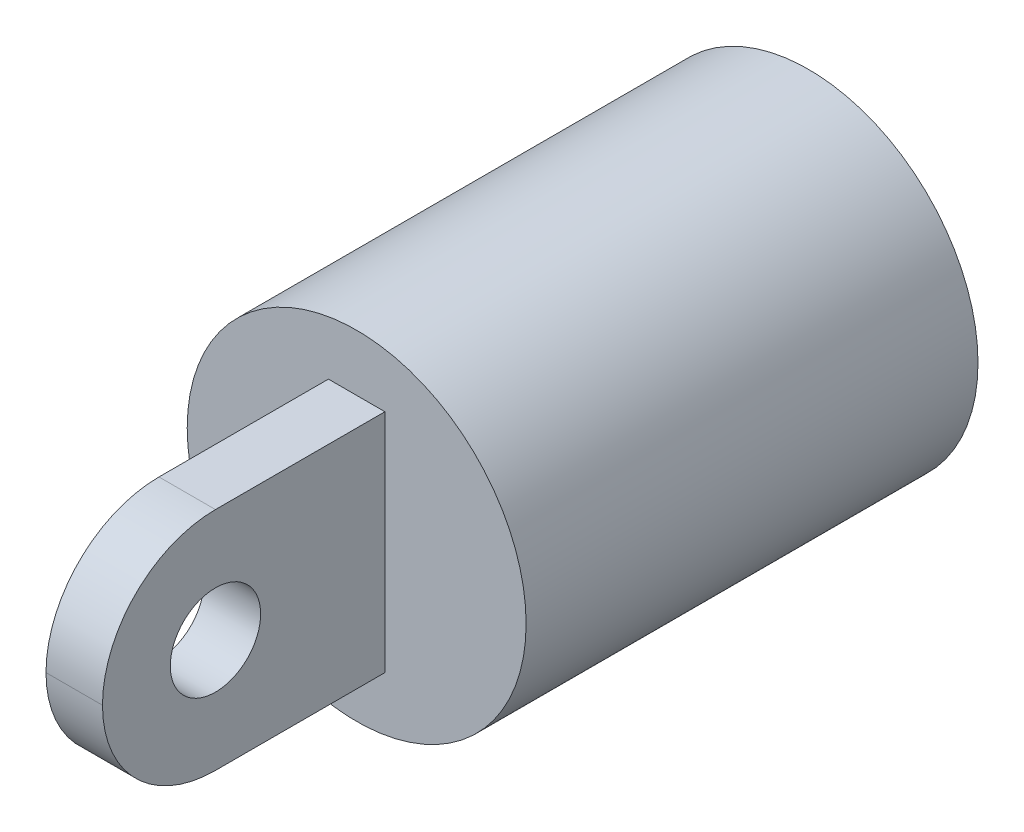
SolidWorks part; units mm, degrees
ref_plane "Plan de face" through (0, 0, 0) normal (0, 0, 1) x (1, 0, 0)
ref_plane "Plan de dessus" through (0, 0, 0) normal (0, 1, 0) x (1, 0, 0)
ref_plane "Plan de droite" through (0, 0, 0) normal (1, 0, 0) x (0, 0, -1)
sketch "Esquisse1" plane through (0, 0, 0) normal (0, 0, 1) x (1, 0, 0)
  circle A0 centre (0, 0) radius 15
  dimension "D1" = 30
extrude "Boss.-Extru.1" add sketch "Esquisse1" along normal blind 40
sketch "Esquisse2" plane through (0, 0, 40) normal (0, 0, 1) x (1, 0, 0)
  line L1 (-2.5, 10) -> (2.5, 10)
  line L2 (-2.5, 10) -> (-2.5, -10)
  line L3 (-2.5, -10) -> (2.5, -10)
  line L4 (2.5, 10) -> (2.5, -10)
  circle A0 centre (0, 0) radius 15 construction
  point P4 (0, 10)
  dimension "D1" = 20
  dimension "D2" = 5
  dimension "D3" = 10
  dimension "D4" = 2.5
extrude "Boss.-Extru.2" add sketch "Esquisse2" along normal blind 25
fillet "Congé1" radius 10 2 edges at (0, 10, 65) (0, -10, 65)
sketch "Esquisse4" plane through (2.5, 0, 0) normal (1, 0, 0) x (0, 0, -1)
  circle A0 centre (-55, 0) radius 4
  arc A1 (-55, 10) -> (-65, 0) centre (-55, 0) ccw construction
  dimension "D1" = 8
extrude "Enlèv. mat.-Extru.1" cut sketch "Esquisse4" against normal blind 25
sketch "Esquisse5" plane through (0, 0, 0) normal (0, 0, -1) x (-1, 0, 0)
  circle A0 centre (0, 0) radius 5.1
  circle A1 centre (0, 0) radius 15 construction
  dimension "D1" = 10.2
extrude "Enlèv. mat.-Extru.2" cut sketch "Esquisse5" against normal blind 30
